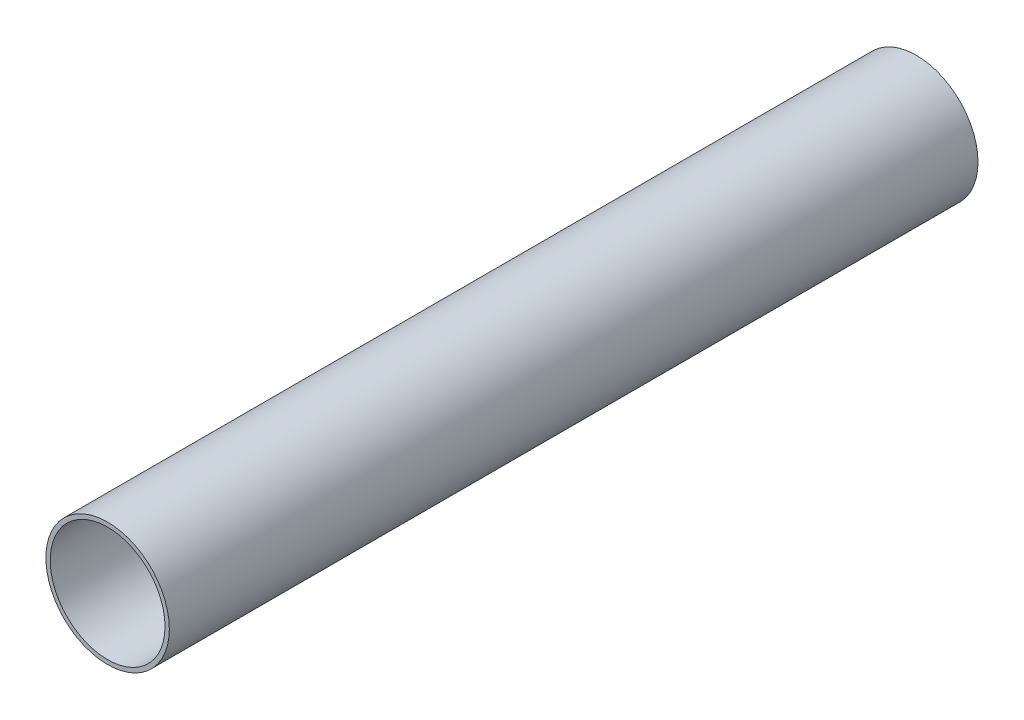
SolidWorks part; units mm, degrees
ref_plane "Front Plane" through (0, 0, 0) normal (0, 0, 1) x (1, 0, 0)
ref_plane "Top Plane" through (0, 0, 0) normal (0, 1, 0) x (1, 0, 0)
ref_plane "Right Plane" through (0, 0, 0) normal (1, 0, 0) x (0, 0, -1)
sketch "Sketch1" plane through (0, 0, 0) normal (0, 0, 1) x (1, 0, 0)
  circle A0 centre (0, 0) radius 27.051
  circle A1 centre (0, 0) radius 29.083
extrude "Extrude2" add sketch "Sketch1" along normal blind 381
